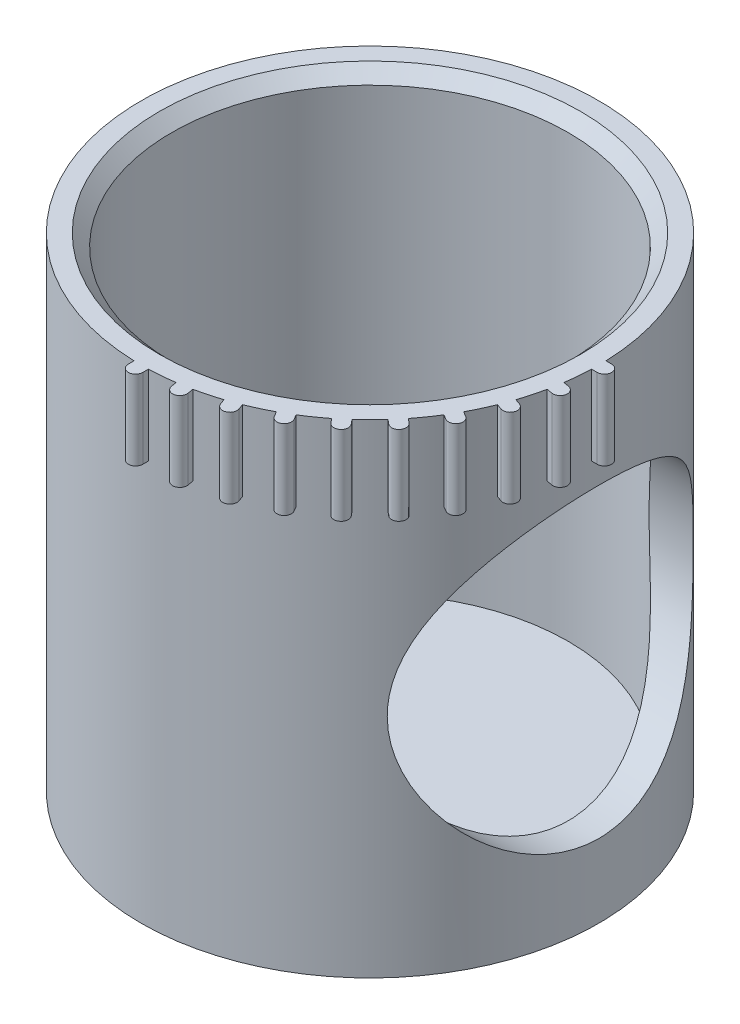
SolidWorks part; units mm, degrees
ref_plane "Front Plane" through (0, 0, 0) normal (0, 0, 1) x (1, 0, 0)
ref_plane "Top Plane" through (0, 0, 0) normal (0, 1, 0) x (1, 0, 0)
ref_plane "Right Plane" through (0, 0, 0) normal (1, 0, 0) x (0, 0, -1)
sketch "Esquisse6" plane through (0, 0, 0) normal (0, 1, 0) x (1, 0, 0)
  circle A0 centre (0, 0) radius 16.2
  dimension "D1" = 32.4
extrude "Boss.-Extru.2" add sketch "Esquisse6" along normal blind 37
shell "Coque2" thickness 2.5
sketch "Esquisse7" plane through (0, 0, 0) normal (1, 0, 0) x (0, 0, -1)
  circle A0 centre (0, 16) radius 12.5
  dimension "D1" = 25
  dimension "D2" = 16
extrude "Enlèv. mat.-Extru.3" cut sketch "Esquisse7" along normal through all
sketch "Esquisse8" plane through (0, 37, 0) normal (0, 1, 0) x (1, 0, 0)
  line L0 (-0.5897, -18.6907) -> (0.5897, -18.6907)
  line L1 (-0.5897, -18.6907) -> (-0.5897, -19.1541)
  line L3 (0.5897, -18.6907) -> (0.5897, -19.1541)
  line L4 (0, -55) -> (0, 55) construction
  circle A0 centre (0, 0) radius 18.7 construction
  arc A3 (-0.5897, -19.1541) -> (0.5897, -19.1541) centre (0, -19.1541) ccw
  dimension "D1" = 0.75
extrude "Boss.-Extru.4" add sketch "Esquisse8" against normal blind 6.5
pattern_circular "Répétition circulaire2" count 10 over 90 about axis through (0, 0, 0) along (0, 1, 0) of "Boss.-Extru.4"
chamfer "Chanfrein1" distance 1 angle 45 1 edges at (0, 37, 16.2)
